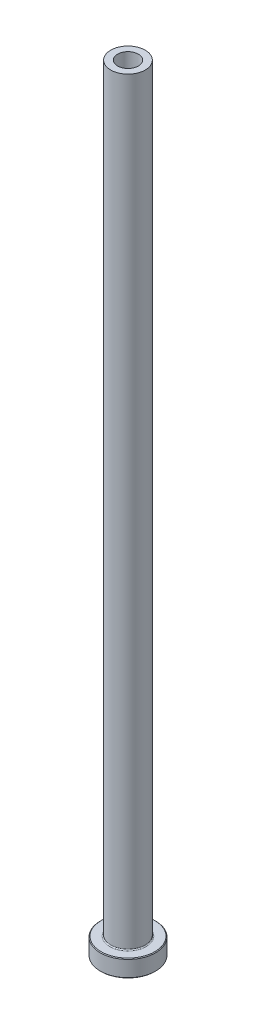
SolidWorks part; units mm, degrees
ref_plane "Front Plane" through (0, 0, 0) normal (0, 0, 1) x (1, 0, 0)
ref_plane "Top Plane" through (0, 0, 0) normal (0, 1, 0) x (1, 0, 0)
ref_plane "Right Plane" through (0, 0, 0) normal (1, 0, 0) x (0, 0, -1)
sketch "Sketch1" plane through (0, 0, 0) normal (0, 0, 1) x (1, 0, 0)
  line L0 (-3, 225) -> (-5, 225)
  line L1 (-5, 225) -> (-5, 5)
  line L2 (-5, 5) -> (-8, 5)
  line L3 (-8, 5) -> (-8, 0)
  line L4 (8.8, 0) -> (-8.8, 0) construction
  line L5 (-8, 0) -> (-3.25, 0)
  line L6 (-3, 180) -> (-3, 225)
  line L7 (0, 92.1877) -> (0, -15.5353) construction
  line L8 (0, -8.8) -> (0, 8.8) construction
  line L9 (-3, 180) -> (-3.25, 168)
  line L10 (-3.25, 168) -> (-3.25, 0)
  dimension "D1" = 0.25
  dimension "ID" = 6
  dimension "OD" = 10
  dimension "L" = 225
  dimension "H" = 16
  dimension "T" = 5
  dimension "N" = 45
  dimension "D2" = 12
revolve "Revolve1" add sketch "Sketch1" angle 360 about L7
fillet "Fillet1" radius 0.3 1 edges at (0, 5, 5)
chamfer "Chamfer1" distance 0.2 angle 45 2 edges at (0, 5, 8) (0, 0, 8)
chamfer "Chamfer3" distance 0.5 angle 45 1 edges at (0, 0, 3.25)
